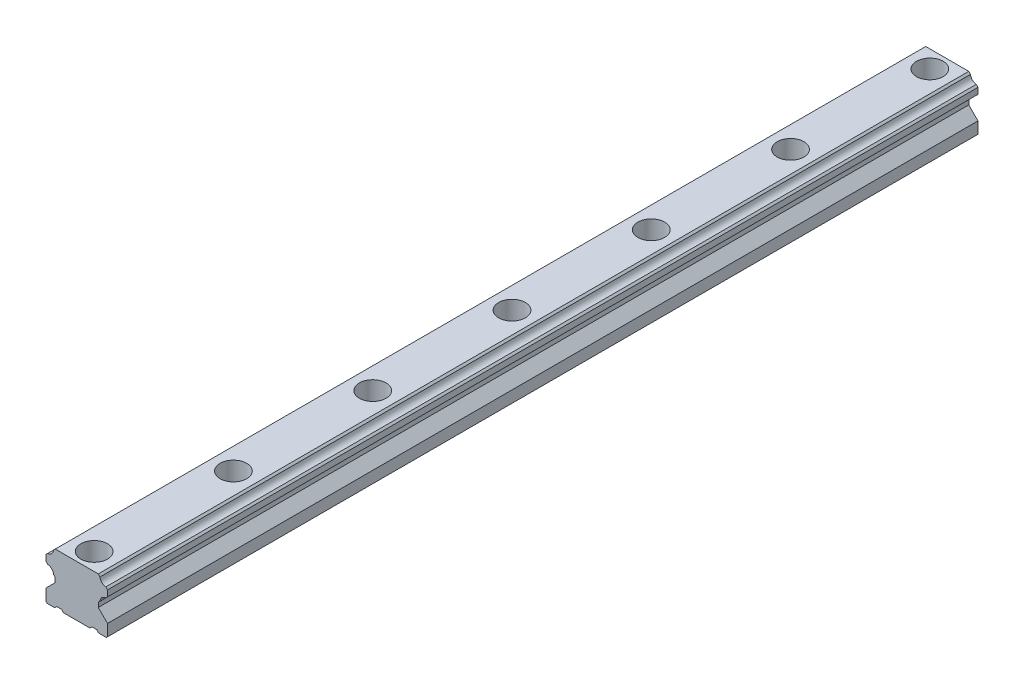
SolidWorks part; units mm, degrees
ref_plane "Front Plane" through (0, 0, 0) normal (0, 0, 1) x (1, 0, 0)
ref_plane "Top Plane" through (0, 0, 0) normal (0, 1, 0) x (1, 0, 0)
ref_plane "Right Plane" through (0, 0, 0) normal (1, 0, 0) x (0, 0, -1)
sketch "Sketch2" plane through (0, 0, 0) normal (0, 0, 1) x (1, 0, 0)
  line L0 (-11.2249, -22.0222) -> (11.4894, -22.0222)
  line L1 (11.4894, -22.0222) -> (13.2561, -20.2555)
  line L2 (13.2561, -20.2555) -> (17.2942, -20.2555)
  line L3 (17.2942, -20.2555) -> (19.0608, -22.0222)
  line L4 (19.0608, -22.0222) -> (25.6323, -22.0222)
  line L5 (25.6323, -22.0222) -> (26.6323, -21.0222)
  line L6 (26.6323, -21.0222) -> (26.6323, -11.0222)
  line L7 (26.6323, -11.0222) -> (18.6823, -3.0722)
  line L8 (18.6823, -3.0722) -> (18.6823, 0.8278)
  line L9 (18.6823, 0.8278) -> (20.1784, 2.3239)
  line L10 (25.1361, 7.2816) -> (26.6323, 8.7778)
  line L11 (26.6323, 8.7778) -> (26.6323, 14.0278)
  line L12 (26.6323, 14.0278) -> (25.1361, 15.5239)
  line L13 (20.1784, 20.4816) -> (18.6823, 21.9778)
  line L14 (18.6823, 21.9778) -> (-18.4177, 21.9778)
  line L15 (-18.4177, 21.9778) -> (-19.9139, 20.4816)
  line L16 (-24.8716, 15.5239) -> (-26.3677, 14.0278)
  line L17 (-26.3677, 14.0278) -> (-26.3677, 8.7778)
  line L18 (-26.3677, 8.7778) -> (-24.8716, 7.2816)
  line L19 (-19.9139, 2.3239) -> (-18.4177, 0.8278)
  line L20 (-18.4177, 0.8278) -> (-18.4177, -3.0722)
  line L21 (-18.4177, -3.0722) -> (-26.3677, -11.0222)
  line L22 (-26.3677, -11.0222) -> (-26.3677, -21.0222)
  line L23 (-26.3677, -21.0222) -> (-25.3677, -22.0222)
  line L24 (-25.3677, -22.0222) -> (-18.7963, -22.0222)
  line L25 (-18.7963, -22.0222) -> (-17.0296, -20.2555)
  line L26 (-17.0296, -20.2555) -> (-12.9915, -20.2555)
  line L27 (-12.9915, -20.2555) -> (-11.2249, -22.0222)
  arc A0 (25.1361, 7.2816) -> (20.1784, 2.3239) centre (25.468, 1.992) ccw
  arc A1 (20.1784, 20.4816) -> (25.1361, 15.5239) centre (25.468, 20.8135) ccw
  arc A2 (-24.8716, 15.5239) -> (-19.9139, 20.4816) centre (-25.2035, 20.8135) ccw
  arc A3 (-19.9139, 2.3239) -> (-24.8716, 7.2816) centre (-25.2035, 1.992) ccw
extrude "Boss-Extrude1" add sketch "Sketch2" along normal blind 750
sketch "Sketch3" plane through (0, 21.9778, 0) normal (0, 1, 0) x (1, 0, 0)
  line L0 (26.6323, -750) -> (26.6323, 0) construction
  line L2 (18.6823, 0) -> (-18.4177, 0) construction
  point P0 (0.1323, -15)
  dimension "D1" = 26.5
  dimension "D2" = 15
hole_wizard "CBORE for M16 Hex Head Bolt1" positions "Sketch3" profile "Sketch4" counterbore size "M16" standard "DIN"
sketch "Sketch4" plane through (0.1323, 21.9778, 15) normal (1, 0, 0) x (0, 0, 1)
  line L0 (0, 0) -> (0, 44)
  line L1 (0, 44) -> (8, 44)
  line L3 (8, 44) -> (8, 20)
  line L4 (8, 20) -> (11.5, 20)
  line L5 (11.5, 20) -> (11.5, 0)
  line L7 (11.5, 0) -> (0, 0)
  line L11 (0, -6.35) -> (0, 107.95) construction
  dimension "Thru Hole Dia." = 16
  dimension "Thru Hole Depth" = 44
  dimension "C'Bore Dia." = 23
  dimension "C'Bore Depth" = 20
other "Fill Pattern1" parameters "D5"=0, "D6"=0, "D1"=120, "D2"=60, "D3"=0, "D9"=7, "D7"=7, "D8"=2
